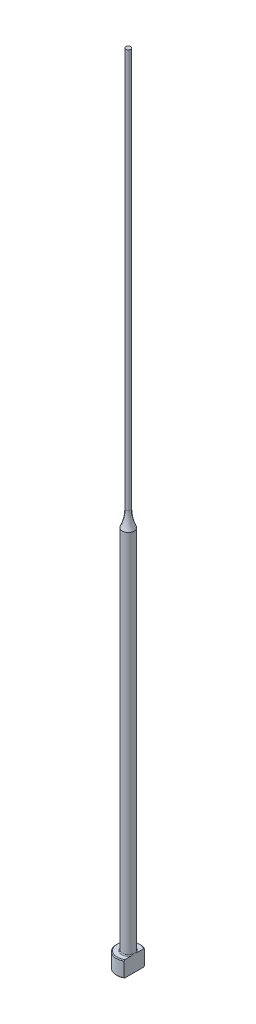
SolidWorks part; units mm, degrees
ref_plane "Front Plane" through (0, 0, 0) normal (0, 0, 1) x (1, 0, 0)
ref_plane "Top Plane" through (0, 0, 0) normal (0, 1, 0) x (1, 0, 0)
ref_plane "Right Plane" through (0, 0, 0) normal (1, 0, 0) x (0, 0, -1)
sketch "Sketch1" plane through (0, 0, 0) normal (0, 0, 1) x (1, 0, 0)
  line L0 (0, 259.9588) -> (0, -15.1925) construction
  line L1 (0, 0) -> (-3, 0)
  line L2 (-3, 0) -> (-3, 4)
  line L3 (-3, 4) -> (-1.5, 4)
  line L4 (-0.6, 100) -> (-0.6, 200)
  line L5 (-0.6, 200) -> (0, 200)
  line L6 (0, 200) -> (0, 0)
  line L7 (-1.5, 4) -> (-1.5, 95.8539)
  arc A0 (-1.5, 95.8539) -> (-0.6, 100) centre (-10.6, 100) ccw
  point P13 (-1.5, 0)
  dimension "D1" = 10
  dimension "L" = 200
  dimension "H" = 6
  dimension "T" = 4
  dimension "D" = 1.2
  dimension "B" = 3
  dimension "S" = 100
revolve "Revolve1" add sketch "Sketch1" angle 360 about L0
chamfer "Chamfer1" distance 0.2 angle 45 2 edges at (0, 4, 3) (0, 0, 3)
fillet "Fillet1" radius 0.2 1 edges at (0, 4, 1.5)
sketch "Sketch2" plane through (0, 0, 0) normal (0, 1, 0) x (1, 0, 0)
  line L0 (1.5, -2.5981) -> (1.5, 2.5981)
  circle A0 centre (0, 0) radius 3 construction
  arc A1 (1.5, -2.5981) -> (1.5, 2.5981) centre (0, 0) ccw
  circle A2 centre (0, 0) radius 1.5 construction
extrude "Keyed Head" cut sketch "Sketch2" along normal through all
